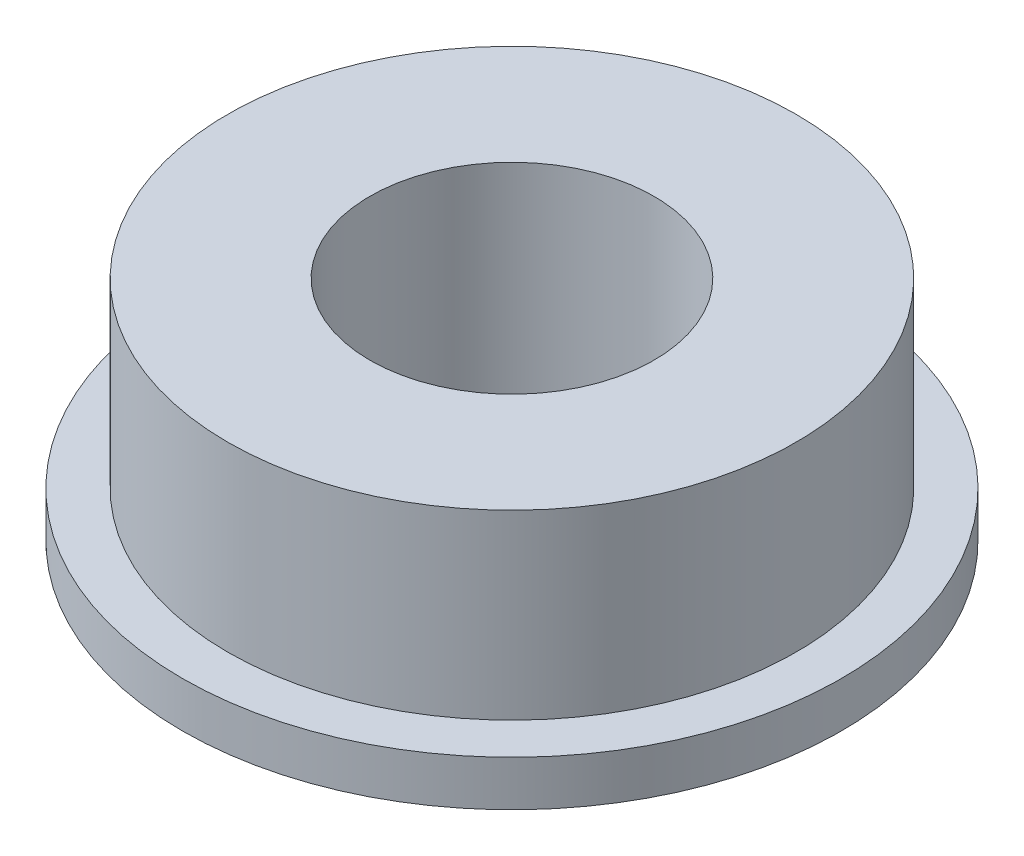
SolidWorks part; units mm, degrees
ref_plane "Спереди" through (0, 0, 0) normal (0, 0, 1) x (1, 0, 0)
ref_plane "Сверху" through (0, 0, 0) normal (0, 1, 0) x (1, 0, 0)
ref_plane "Справа" through (0, 0, 0) normal (1, 0, 0) x (0, 0, -1)
sketch "Эскиз1" plane through (0, 0, 0) normal (0, 1, 0) x (1, 0, 0)
  circle A0 centre (0, 0) radius 5.8
  circle A1 centre (0, 0) radius 2.5
  dimension "D1" = 11.6
  dimension "D2" = 5
extrude "Бобышка-Вытянуть1" add sketch "Эскиз1" along normal blind 0.8
sketch "Эскиз2" plane through (0, 0.8, 0) normal (0, 1, 0) x (1, 0, 0)
  circle A1 centre (0, 0) radius 2.5 construction
  circle A3 centre (0, 0) radius 5
  circle A4 centre (0, 0) radius 2.5
  dimension "D2" = 10
extrude "Бобышка-Вытянуть2" add sketch "Эскиз2" along normal blind 4 from surface at -0.8 contours A3
